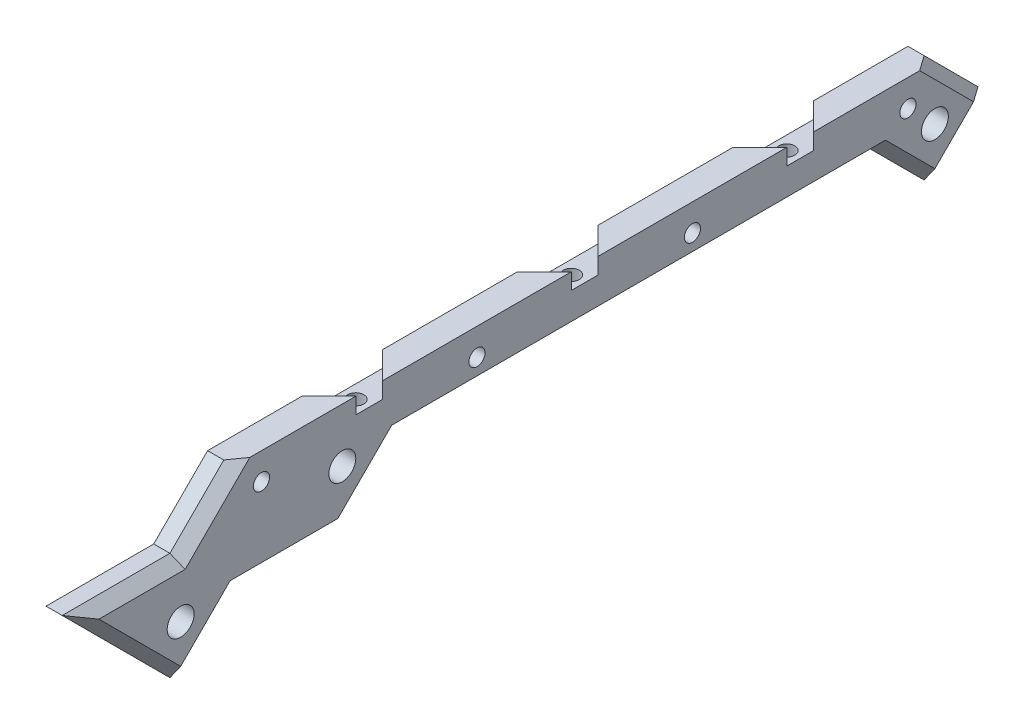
SolidWorks part; units mm, degrees
ref_plane "Alzado" through (0, 0, 0) normal (0, 0, 1) x (1, 0, 0)
ref_plane "Planta" through (0, 0, 0) normal (0, 1, 0) x (1, 0, 0)
ref_plane "Vista lateral" through (0, 0, 0) normal (1, 0, 0) x (0, 0, -1)
sketch "Croquis1" plane through (0, 0, 0) normal (1, 0, 0) x (0, 0, -1)
  line L0 (0, 0) -> (0, 51622.794) construction
  line L1 (0, 0) -> (51622.794, 0) construction
  line L2 (75, 0) -> (65, 10)
  line L3 (-75, 10) -> (75, 10) construction
  line L4 (-75, 10) -> (-75, -10) construction
  line L5 (-75, -10) -> (75, -10) construction
  line L6 (75, 10) -> (75, -10) construction
  line L7 (-75, 10) -> (75, -10) construction
  line L8 (-75, -10) -> (75, 10) construction
  line L9 (65, 10) -> (-65, 10)
  line L10 (-65, 10) -> (-75, 0)
  line L11 (-75, 0) -> (-95, 0)
  line L14 (-45, -10) -> (-35, 0)
  line L16 (-95, 0) -> (-75, -20)
  line L17 (-45, 0) -> (-45, -10) construction
  line L18 (75, 0) -> (65, -10)
  line L20 (55, 0) -> (-35, 0)
  line L21 (-75, -20) -> (-65, -10)
  line L22 (-65, -10) -> (-45, -10)
  line L23 (-65, -10) -> (-85, -10) construction
  line L24 (65, 10) -> (65, -10) construction
  line L25 (55, 0) -> (65, -10)
  circle A0 centre (-45, 0) radius 2.5
  circle A1 centre (65, 0) radius 2.5
  circle A2 centre (-75, -10) radius 2.5
  point P5 (0, 0)
  dimension "D7" = 5
  dimension "D1" = 20
  dimension "D2" = 150
  dimension "D3" = 40
  dimension "D4" = 45
  dimension "D5" = 20
  dimension "D6" = 20
  dimension "D8" = 20
extrude "Saliente-Extruir1" add sketch "Croquis1" along normal blind 5
chamfer "Chaflán1" distance 2 angle 45 11 edges at (5, 5, -70) (5, -5, -70) (5, -5, -60) (5, 0, -10) (5, -5, 40) (5, -10, 55) (5, -15, 70) (5, -10, 85) (5, 0, 85) (5, 5, 70) (5, 10, 0)
sketch "Croquis2" plane through (5, 0, 0) normal (1, 0, 0) x (0, 0, -1)
  line L0 (-60, 5) -> (60, 5) construction
  line L1 (60, 5) -> (68.5858, -3.5858) construction
  line L2 (65, -7.1716) -> (72.1716, 0) construction
  line L3 (0, 5) -> (0, 2) construction
  line L6 (72.1716, 0) -> (62.1716, 10) construction
  line L7 (-60, 5) -> (-80, -15) construction
  line L8 (-75, -20) -> (-95, 0) construction
  line L9 (-65, -10) -> (-75, -20) construction
  line L10 (-35.8284, 2) -> (55.8284, 2) construction
  circle A0 centre (-60, 5) radius 1.5
  circle A1 centre (60, 5) radius 1.5
  circle A2 centre (-20, 5) radius 1.5
  circle A3 centre (20, 5) radius 1.5
  circle A4 centre (-75, -10) radius 2.5 construction
  circle A5 centre (-75, -10) radius 2.5 construction
  point P23 (68.5858, -3.5858)
  dimension "D1" = 3
  dimension "D2" = 40
  dimension "D3" = 40
  dimension "D4" = 3
extrude "Cortar-Extruir1" cut sketch "Croquis2" against normal through all
sketch "Croquis5" plane through (0, 10, 0) normal (0, 1, 0) x (1, 0, 0)
  line L0 (2.5, 0) -> (0, 0) construction
  line L1 (0, 65) -> (0, -65) construction
  line L2 (0, 7.5) -> (5, 2.5)
  line L3 (5, 62.1716) -> (5, -62.1716) construction
  line L4 (5, 2.5) -> (5, -2.5)
  line L5 (5, -2.5) -> (0, -7.5)
  line L6 (0, -7.5) -> (0, 7.5)
  line L7 (2.5, 0) -> (5, 0) construction
  line L8 (2.5, 0) -> (2.5, -40) construction
  line L9 (2.5, 0) -> (2.5, 40) construction
  line L10 (5, -42.5) -> (0, -47.5)
  line L11 (5, -37.5) -> (5, -42.5)
  line L12 (0, -32.5) -> (5, -37.5)
  line L13 (0, -47.5) -> (0, -32.5)
  line L14 (5, 37.5) -> (0, 32.5)
  line L15 (5, 42.5) -> (5, 37.5)
  line L16 (0, 47.5) -> (5, 42.5)
  line L17 (0, 32.5) -> (0, 47.5)
  circle A0 centre (2.5, 0) radius 1.5 construction
  circle A1 centre (2.5, -40) radius 1.5 construction
  circle A2 centre (2.5, 40) radius 1.5 construction
  dimension "D1" = 3
  dimension "D2" = 2.5
  dimension "D3" = 45
  dimension "D4" = 15
  dimension "D5" = 40
  dimension "D6" = 40
  dimension "D8" = 40
  dimension "D10" = 25
  dimension "D7" = 2
  dimension "D9" = 2
extrude "Cortar-Extruir2" cut sketch "Croquis5" against normal blind 3
sketch "Croquis6" plane through (0, 7, 0) normal (0, 1, 0) x (1, 0, 0)
  line L0 (5, 40) -> (0, 40) construction
  line L1 (5, 37.5) -> (5, 42.5) construction
  line L2 (0, 47.5) -> (0, 32.5) construction
  line L3 (2.5, 0) -> (5, 0) construction
  line L4 (5, -2.5) -> (5, 2.5) construction
  circle A0 centre (2.5, 40) radius 1.5
  circle A1 centre (2.5, 0) radius 1.5
  circle A2 centre (2.5, -40) radius 1.5
  dimension "D1" = 3
  dimension "D2" = 3
extrude "Cortar-Extruir3" cut sketch "Croquis6" against normal through all
